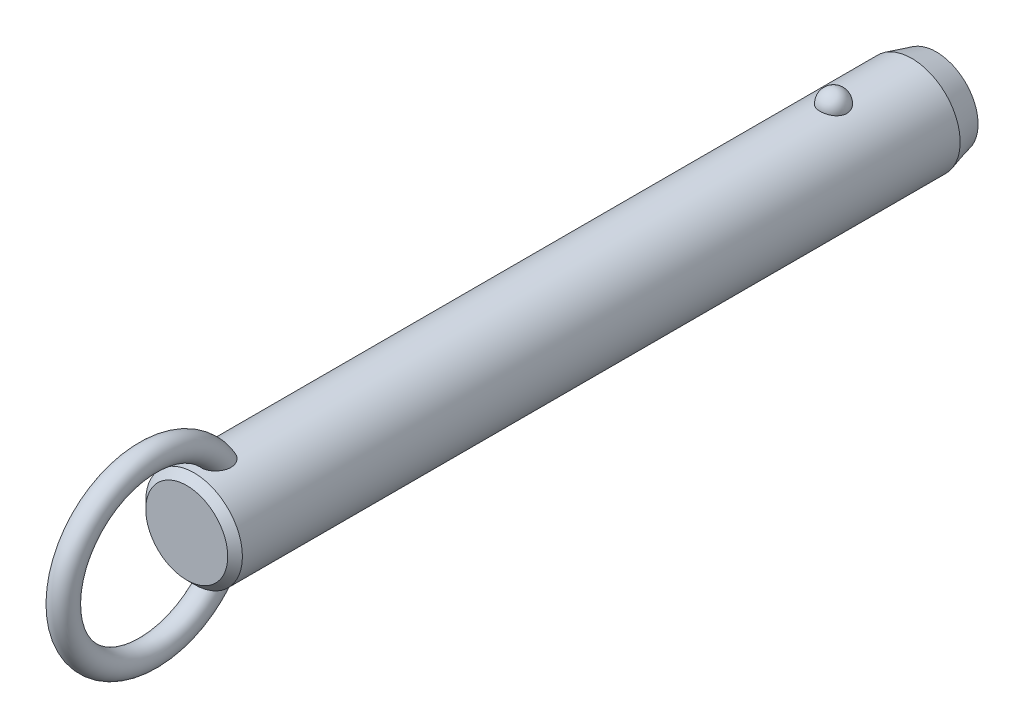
SolidWorks part; units mm, degrees
ref_plane "Front Plane" through (0, 0, 0) normal (0, 0, 1) x (1, 0, 0)
ref_plane "Top Plane" through (0, 0, 0) normal (0, 1, 0) x (1, 0, 0)
ref_plane "Right Plane" through (0, 0, 0) normal (1, 0, 0) x (0, 0, -1)
sketch "Sketch2" plane through (0, 0, 0) normal (0, 0, 1) x (1, 0, 0)
  circle A0 centre (0, 0) radius 7.9
  point P3 (0, 7.9)
  dimension "D1" = 15.8
extrude "Boss-Extrude1" add sketch "Sketch2" along normal blind 94
sketch "Sketch3" plane through (0, 0, 0) normal (0, 0, -1) x (-1, 0, 0)
  circle A0 centre (0, 0) radius 7.9
  dimension "D1" = 15.8
extrude "Boss-Extrude2" add sketch "Sketch3" along normal blind 19
chamfer "Chamfer1" distance 4 angle 15 1 edges at (-7.9, 0, -19)
sketch "Sketch12" plane through (0, 0, 0) normal (1, 0, 0) x (0, 0, -1)
  line L0 (-94, 7.9) -> (-94, -7.9) construction
  point P0 (-94, 0)
sketch "Sketch13" plane through (0, 0, 0) normal (1, 0, 0) x (0, 0, -1)
  circle A0 centre (-109.85, 0) radius 15.85
  point P2 (-94, 0)
  dimension "D1" = 31.7
sketch "Sketch14" plane through (0, 0, 0) normal (0, 1, 0) x (1, 0, 0)
  circle A0 centre (0, -96) radius 2
  point P2 (0, -94)
  dimension "D1" = 4
sweep "Sweep1" add profiles "Sketch14" path "Sketch13"
sketch "Sketch15" plane through (0, 0, 94) normal (0, 0, 1) x (1, 0, 0)
  circle A0 centre (0, 0) radius 7.9
  dimension "D1" = 15.8
extrude "Boss-Extrude3" add sketch "Sketch15" along normal blind 9.52
chamfer "Chamfer2" distance 1.2 angle 45 1 edges at (7.9, 0, 103.52)
sketch "Sketch18" plane through (0, 0, 0) normal (1, 0, 0) x (0, 0, -1)
  line L0 (15, 7.9) -> (-96.1091, 7.9) construction
  line L1 (2.2, 10.1) -> (2.2, 5.7)
  line L2 (-96.1091, -7.9) -> (15, -7.9) construction
  arc A0 (2.2, 10.1) -> (2.2, 5.7) centre (2.2, 7.9) ccw
  point P4 (0, 7.9)
  dimension "D1" = 18
revolve "Revolve1" add sketch "Sketch18" angle 360 about L1
